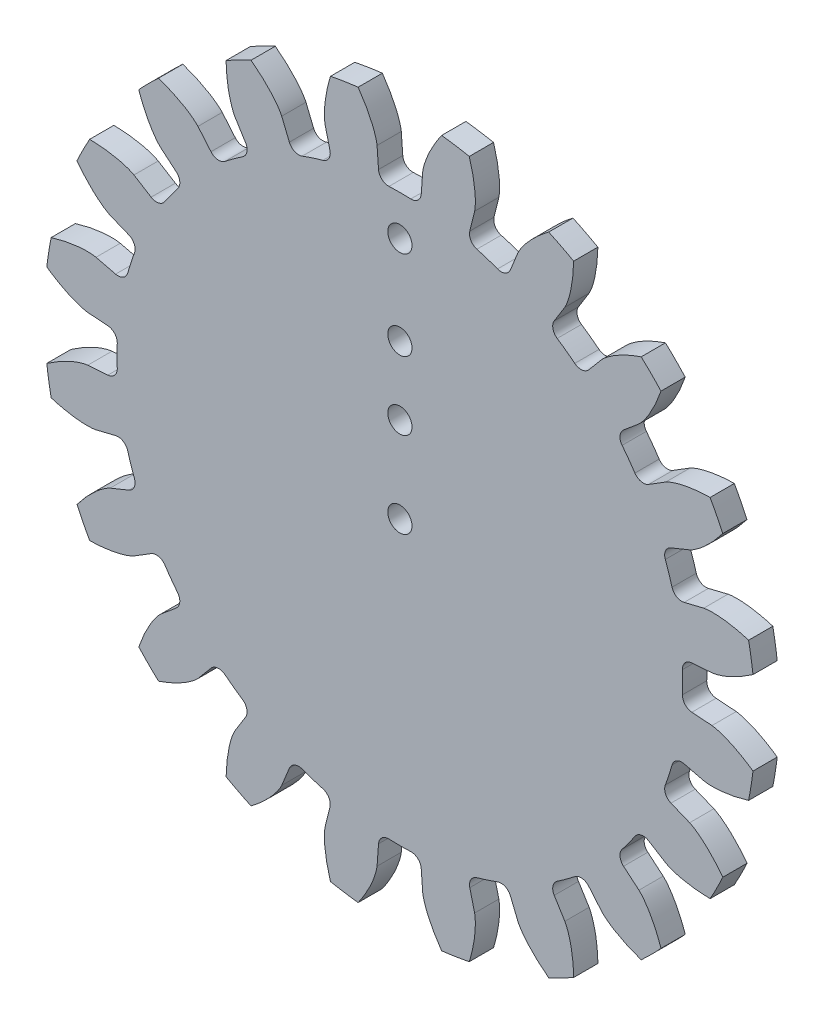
SolidWorks part; units mm, degrees
ref_plane "Front Plane" through (0, 0, 0) normal (0, 0, 1) x (1, 0, 0)
ref_plane "Top Plane" through (0, 0, 0) normal (0, 1, 0) x (1, 0, 0)
ref_plane "Right Plane" through (0, 0, 0) normal (1, 0, 0) x (0, 0, -1)
sketch "BaseCylinderSketch" plane through (0, 0, 0) normal (0, 0, 1) x (1, 0, 0)
  circle A0 centre (0, 0) radius 46.5667
  circle A1 centre (0, 0) radius 1.5875
extrude "BaseCylinder" add sketch "BaseCylinderSketch" along normal blind 3.175
sketch "InvoluteCurvesAndToothGulletSketch" plane through (0, 0, 3.175) normal (0, 0, 1) x (1, 0, 0)
  line L0 (36.943, 2.7015) -> (0, 0) construction
  line L1 (0, 0) -> (36.943, -2.7015) construction
  line L2 (36.943, -2.7015) -> (40.8758, -2.989)
  line L3 (36.943, 2.7015) -> (40.8758, 2.989)
  circle A0 centre (0, 0) radius 37.0417 construction
  circle A1 centre (0, 0) radius 40.9849 construction
  circle A2 centre (0, 0) radius 42.3333 construction
  circle A3 centre (0, 0) radius 46.5667 construction
  arc A4 (36.943, 2.7015) -> (36.943, -2.7015) centre (0, 0) cw
  spline S0 degree 4 poles (40.8758, 2.989) (40.8846, 2.9898) (40.9092, 2.9922) (40.9556, 2.9979) (41.0312, 3.0091) (41.1273, 3.0258) (41.2512, 3.0504) (41.3967, 3.0831) (41.5561, 3.123) (41.729, 3.1706) (41.9009, 3.222) (42.0719, 3.2766) (42.2418, 3.3343) (42.447, 3.4078) (42.6921, 3.5011) (42.9774, 3.6177) (43.2993, 3.7587) (43.6255, 3.9119) (43.945, 4.0704) (44.266, 4.2395) (44.5751, 4.4093) (44.8943, 4.5948) (45.1878, 4.7707) (45.5144, 4.9777) (45.7772, 5.1477) (46.1214, 5.3825) (46.3238, 5.5244) (46.5598, 5.6941) (46.6641, 5.7714) (46.7284, 5.8189) knots 0 0 0 0 0 0.005377 0.015084 0.028532 0.04661 0.064855 0.092111 0.119476 0.146842 0.174209 0.201575 0.228941 0.256307 0.307035 0.361767 0.4165 0.471232 0.525964 0.580697 0.635429 0.690161 0.744894 0.799626 0.854358 0.909091 0.954545 1 1 1 1 1 construction
  spline S1 degree 4 poles (40.8758, 2.989) (40.8846, 2.9898) (40.9092, 2.9922) (40.9556, 2.9979) (41.0312, 3.0091) (41.1273, 3.0258) (41.2512, 3.0504) (41.3967, 3.0831) (41.5561, 3.123) (41.729, 3.1706) (41.9009, 3.222) (42.0719, 3.2766) (42.2418, 3.3343) (42.447, 3.4078) (42.6921, 3.5011) (42.9774, 3.6177) (43.2993, 3.7587) (43.6255, 3.9119) (43.945, 4.0704) (44.266, 4.2395) (44.5751, 4.4093) (44.8943, 4.5948) (45.1878, 4.7707) (45.5144, 4.9777) (45.7772, 5.1477) (46.0468, 5.3316) (46.1776, 5.4223) (46.2444, 5.4692) knots 0 0 0 0 0 0.005377 0.015084 0.028532 0.04661 0.064855 0.092111 0.119476 0.146842 0.174209 0.201575 0.228941 0.256307 0.307035 0.361767 0.4165 0.471232 0.525964 0.580697 0.635429 0.690161 0.744894 0.799626 0.854358 0.909091 0.909091 0.909091 0.909091 0.909091
  spline S2 degree 4 poles (40.8758, -2.989) (40.8846, -2.9898) (40.9092, -2.9922) (40.9556, -2.9979) (41.0312, -3.0091) (41.1273, -3.0258) (41.2512, -3.0504) (41.3967, -3.0831) (41.5561, -3.123) (41.729, -3.1706) (41.9009, -3.222) (42.0719, -3.2766) (42.2418, -3.3343) (42.447, -3.4078) (42.6921, -3.5011) (42.9774, -3.6177) (43.2993, -3.7587) (43.6255, -3.9119) (43.945, -4.0704) (44.266, -4.2395) (44.5751, -4.4093) (44.8943, -4.5948) (45.1878, -4.7707) (45.5144, -4.9777) (45.7772, -5.1477) (46.1214, -5.3825) (46.3238, -5.5244) (46.5598, -5.6941) (46.6641, -5.7714) (46.7284, -5.8189) knots 0 0 0 0 0 0.005377 0.015084 0.028532 0.04661 0.064855 0.092111 0.119476 0.146842 0.174209 0.201575 0.228941 0.256307 0.307035 0.361767 0.4165 0.471232 0.525964 0.580697 0.635429 0.690161 0.744894 0.799626 0.854358 0.909091 0.954545 1 1 1 1 1 construction
  spline S3 degree 4 poles (40.8758, -2.989) (40.8846, -2.9898) (40.9092, -2.9922) (40.9556, -2.9979) (41.0312, -3.0091) (41.1273, -3.0258) (41.2512, -3.0504) (41.3967, -3.0831) (41.5561, -3.123) (41.729, -3.1706) (41.9009, -3.222) (42.0719, -3.2766) (42.2418, -3.3343) (42.447, -3.4078) (42.6921, -3.5011) (42.9774, -3.6177) (43.2993, -3.7587) (43.6255, -3.9119) (43.945, -4.0704) (44.266, -4.2395) (44.5751, -4.4093) (44.8943, -4.5948) (45.1878, -4.7707) (45.5144, -4.9777) (45.7772, -5.1477) (46.0468, -5.3316) (46.1776, -5.4223) (46.2444, -5.4692) knots 0 0 0 0 0 0.005377 0.015084 0.028532 0.04661 0.064855 0.092111 0.119476 0.146842 0.174209 0.201575 0.228941 0.256307 0.307035 0.361767 0.4165 0.471232 0.525964 0.580697 0.635429 0.690161 0.744894 0.799626 0.854358 0.909091 0.909091 0.909091 0.909091 0.909091
extrude "Tooth" cut sketch "InvoluteCurvesAndToothGulletSketch" against normal through all and the other way through all
sketch "InnerRadius" plane through (0, 0, 0) normal (0, 0, 1) x (1, 0, 0)
  circle A0 centre (0, 0) radius 37.0417 construction
  circle A1 centre (0, 0) radius 37.0417 construction
fillet "ToothGulletFillet" radius 1.3233 2 edges at (36.943, 2.7015, 1.5875) (36.943, -2.7015, 1.5875)
pattern_circular "Teeth" count 20 over 360 about axis through (0, 0, 3.175) along (0, 0, -1) of "ToothGulletFillet", "Tooth"
hole_wizard "1/8 (0.1250) Dowel Hole1" positions "Sketch1" profile "Sketch2" hole size "1/8" standard "ANSI Inch"
sketch "Sketch1" plane through (0, 0, 0) normal (0, 0, -1) x (-1, 0, 0)
  point P0 (0, 11.2215)
  point P2 (0, 20.1795)
  point P4 (0, 31.8115)
sketch "Sketch2" plane through (0, 11.2215, 0) normal (1, 0, 0) x (0, 1, 0)
  line L0 (0, 0) -> (0, 3.175)
  line L1 (0, 3.175) -> (1.5875, 3.175)
  line L2 (1.5875, 3.175) -> (1.5875, 0)
  line L5 (1.5875, 0) -> (0, 0)
  line L11 (0, -6.35) -> (0, 107.95) construction
  dimension "Thru Hole Dia." = 3.175
  dimension "Thru Hole Depth" = 3.175
equation "\"DiametralPitch\"= 6'\"Pitch Diameter\""
equation "\"NumTeeth\"= 20'\"Number of Teeth\""
equation "\"PressureAngle\"= 14.5deg"
equation "\"Addendum\"= 1 / \"DiametralPitch\""
equation "\"Dedendum\"= 1.25 / \"DiametralPitch\""
equation "\"WorkingDepth\"= 2 / \"DiametralPitch\""
equation "\"WholeDepth\"= 2.25 / \"DiametralPitch\""
equation "\"Clearance\"= 0.25 / \"DiametralPitch\""
equation "\"ToothThickness\"= 1.5708 / \"DiametralPitch\""
equation "\"CircularPitch\"= pi / \"DiametralPitch\""
equation "\"PitchCircle\"= \"NumTeeth\" / \"DiametralPitch\""
equation "\"OutsideDiameter\"= ( \"NumTeeth\" + 2 ) / \"DiametralPitch\""
equation "\"Fillet\"= \"Clearance\" * cos ( \"PressureAngle\" ) * tan ( ( 90 + \"PressureAngle\" ) / 2 )"
equation "\"AddendumCircle\"= \"PitchCircle\" + ( 2 * \"Addendum\" )"
equation "\"DedendumCircle\"= \"PitchCircle\" - ( 2 * \"Dedendum\" )"
equation "\"BaseCircle\"= \"PitchCircle\" * cos ( \"PressureAngle\" )"
equation "\"PitchAngle\"= 360deg / \"NumTeeth\""
equation "\"Alpha\"= sqr ( \"PitchCircle\" ^ 2 - \"BaseCircle\" ^ 2 ) / \"BaseCircle\" * 180 / PI - \"PressureAngle\""
equation "\"Beta\"= ( \"PitchAngle\" / 4 - \"Alpha\" )"
equation "\"Phi\"= sqr ( ( \"AddendumCircle\" / 2 ) ^ 2 - ( \"BaseCircle\" / 2 ) ^ 2 ) / ( \"BaseCircle\" / 2 )"
equation "\"D1@BaseCylinderSketch\" = \"OutsideDiameter\""
equation "\"D1@InvoluteCurvesAndToothGulletSketch\" = \"OutsideDiameter\""
equation "\"D2@InvoluteCurvesAndToothGulletSketch\" = \"PitchCircle\""
equation "\"D3@InvoluteCurvesAndToothGulletSketch\" = \"BaseCircle\""
equation "\"D4@InvoluteCurvesAndToothGulletSketch\" = \"DedendumCircle\""
equation "\"D1@ToothGulletFillet\" = \"Fillet\""
equation "\"D1@Teeth\" = \"NumTeeth\""
equation "\"MaterialThickness\"= .125in'\"Gear Thickness\""
equation "\"BoreDiameter\"= .125in'\"Bore Diameter\""
equation "\"D2@BaseCylinderSketch\" = \"BoreDiameter\""
equation "\"D1@BaseCylinder\"=\"MaterialThickness\""
